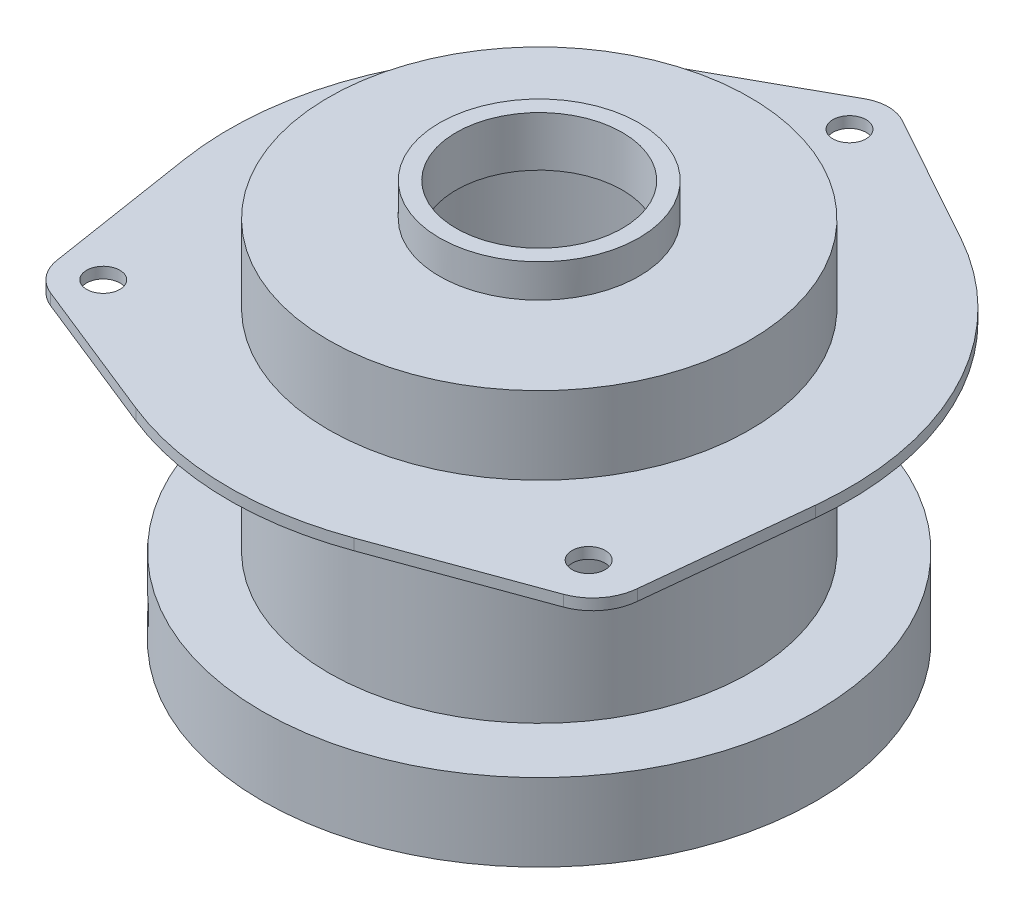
SolidWorks part; units mm, degrees
ref_plane "Plan de face" through (0, 0, 0) normal (0, 0, 1) x (1, 0, 0)
ref_plane "Plan de dessus" through (0, 0, 0) normal (0, 1, 0) x (1, 0, 0)
ref_plane "Plan de droite" through (0, 0, 0) normal (1, 0, 0) x (0, 0, -1)
sketch "Esquisse1" plane through (0, 0, 0) normal (0, 1, 0) x (1, 0, 0)
  circle A0 centre (0, 0) radius 9
extrude "Extrusion1" add sketch "Esquisse1" along normal blind 3
sketch "Esquisse2" plane through (0, 0, 0) normal (0, -1, 0) x (1, 0, 0)
  circle A0 centre (0, 0) radius 19
extrude "Extrusion2" add sketch "Esquisse2" along normal blind 26
sketch "Esquisse4" plane through (0, -26, 0) normal (0, -1, 0) x (1, 0, 0)
  circle A0 centre (0, 0) radius 25
  dimension "D1" = 50
extrude "Extrusion3" add sketch "Esquisse4" along normal blind 7
shell "Coque2" thickness 1.5
sketch "Esquisse5" plane through (0, 1.5, 0) normal (0, -1, 0) x (1, 0, 0)
  circle A0 centre (0, 0) radius 7.5
  dimension "D1" = 15
extrude "Enlèv. mat.-Extru.2" cut sketch "Esquisse5" against normal through all
ref_plane "Plan1" through (0, -7, 0) normal (0, 1, 0) x (-1, 0, 0)
sketch "Esquisse6" plane through (0, -7, 0) normal (0, 1, 0) x (-1, 0, 0)
  line L0 (0, 25) -> (44.8082, 25) construction
  line L1 (0, 0) -> (-52.9183, 0) construction
  line L2 (0, 0) -> (-21.9039, 17.4419) construction
  line L3 (0, 0) -> (0, 44.3013) construction
  line L4 (1.6944, -31.0625) -> (13.5554, -24.5)
  line L5 (-1.6944, -31.0625) -> (-13.5554, -24.5)
  line L6 (25.5194, 18.0085) -> (27.6477, 4.4276)
  line L7 (10.4197, 25.989) -> (23.2658, 20.8387)
  line L8 (-23.4351, 21.2556) -> (-9.5962, 26.3042)
  line L9 (-26.3321, 17.4419) -> (-27.8488, 2.9059)
  circle A0 centre (0, -28) radius 1.5
  circle A1 centre (0, 0) radius 28 construction
  circle A2 centre (0, 0) radius 25 construction
  circle A3 centre (21.9039, 17.4419) radius 1.5
  circle A4 centre (-21.9039, 17.4419) radius 1.5
  arc A5 (-26.3321, 17.4419) -> (-23.4351, 21.2556) centre (-21.9175, 17.0956) cw
  arc A6 (-9.5962, 26.3042) -> (10.4197, 25.989) centre (0, 0) cw
  arc A7 (13.5554, -24.5) -> (27.6477, 4.4276) centre (0, 0) ccw
  circle A8 centre (0, 0) radius 19
  arc A9 (-1.6944, -31.0625) -> (1.6944, -31.0625) centre (0, -28) ccw
  arc A10 (23.2658, 20.8387) -> (25.5194, 18.0085) centre (21.9039, 17.4419) cw
  arc A11 (-27.8488, 2.9059) -> (-13.5554, -24.5) centre (0, 0) ccw
  dimension "D1" = 53
  dimension "D2" = 38.53
extrude "Extrusion4" add sketch "Esquisse6" against normal blind 1
sketch "Esquisse7" plane through (0, 0, 0) normal (1, 0, 0) x (0, 0, -1)
  line L0 (0, 0) -> (0, -38.3518) construction
  line L1 (-19, -29.1165) -> (19, -29.1165)
  line L2 (-19, -29.1165) -> (-19, -30.9628)
  line L3 (-19, -30.9628) -> (19, -30.9628)
  line L4 (19, -29.1165) -> (19, -30.9628)
  dimension "D1" = 38
  dimension "D2" = 19
extrude "Enlèv. mat.-Extru.3" cut sketch "Esquisse7" against normal through all
